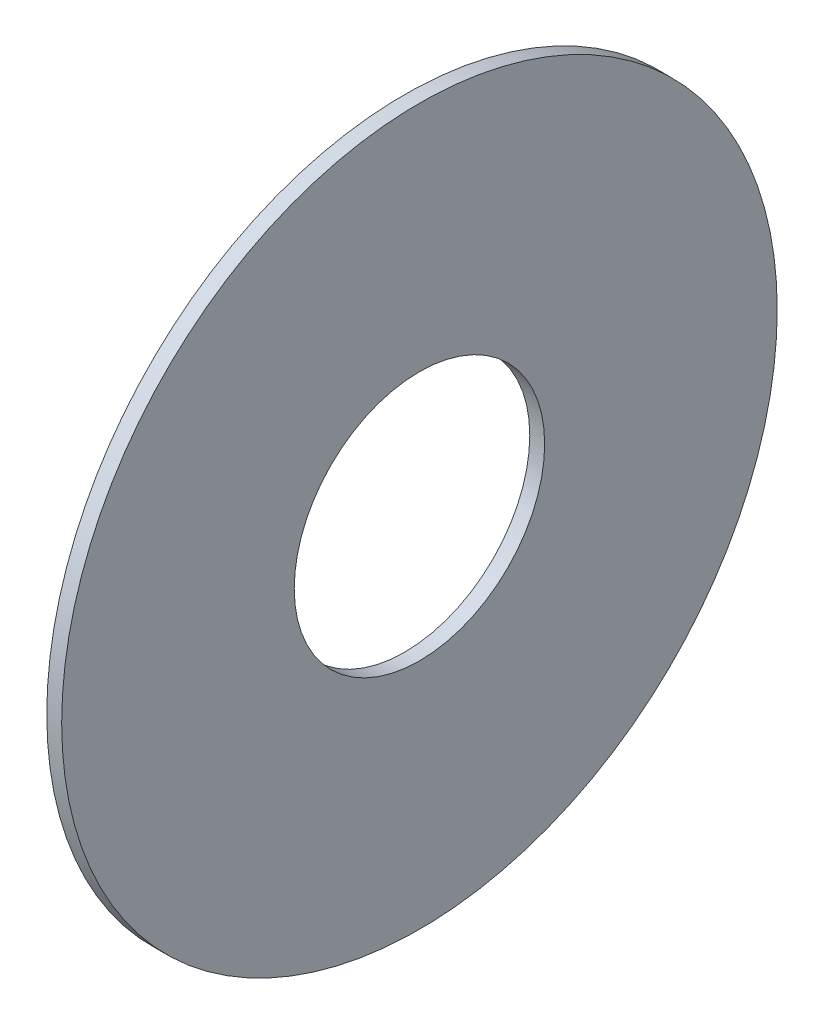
SolidWorks part; units mm, degrees
ref_plane "Plane1" through (0, 0, 0) normal (0, 0, 1) x (1, 0, 0)
ref_plane "Plane2" through (0, 0, 0) normal (0, 1, 0) x (1, 0, 0)
ref_plane "Plane3" through (0, 0, 0) normal (1, 0, 0) x (0, 0, -1)
sketch "Sketch1" plane through (0, 0, 0) normal (0, 0, 1) x (1, 0, 0)
  line L0 (-34.925, 0) -> (9.525, 0) construction
  line L1 (0, 4.2) -> (0, 12)
  line L2 (0, 12) -> (-0.5, 12)
  line L3 (-0.5, 12) -> (-0.5, 4.2)
  line L4 (-0.5, 4.2) -> (0, 4.2)
  dimension "Thickness" = 0.5
  dimension "Inside_dia" = 8.4
  dimension "Outside_dia" = 24
revolve "Base-Revolve" add sketch "Sketch1" angle 360 about L0
